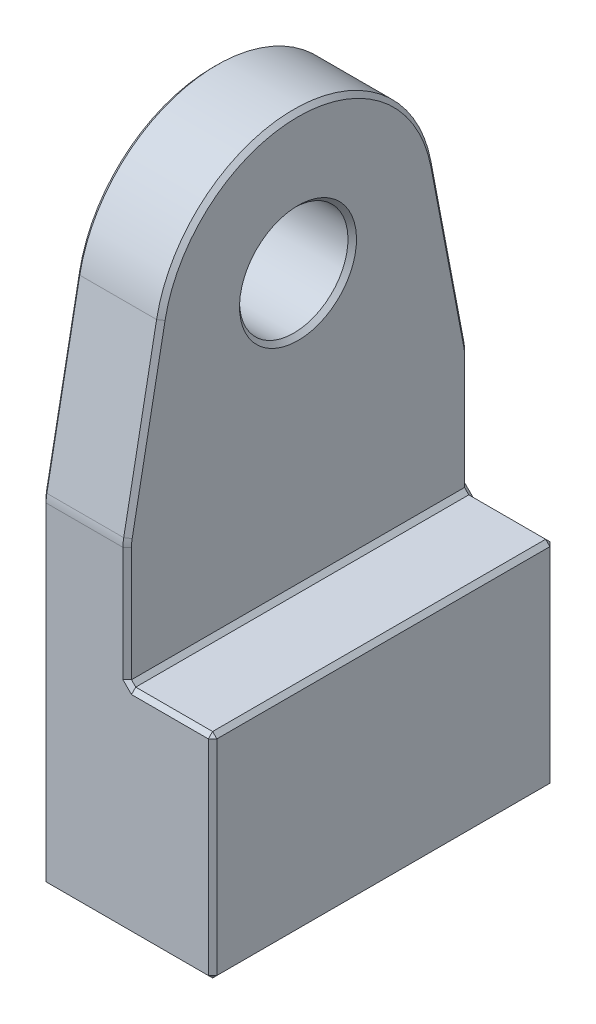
SolidWorks part; units mm, degrees
ref_plane "Спереди" through (0, 0, 0) normal (0, 0, 1) x (1, 0, 0)
ref_plane "Сверху" through (0, 0, 0) normal (0, 1, 0) x (1, 0, 0)
ref_plane "Справа" through (0, 0, 0) normal (1, 0, 0) x (0, 0, -1)
sketch "Эскиз1" plane through (0, 0, 0) normal (1, 0, 0) x (0, 0, -1)
  line L0 (-19.9115, -17.136) -> (-16.0607, 3.062)
  line L1 (-20, -18.0724) -> (-20, -57)
  line L2 (-20, -57) -> (20, -57)
  line L3 (0, 0) -> (0, -57) construction
  line L4 (20, -18.0724) -> (20, -57)
  line L5 (19.9115, -17.136) -> (16.0607, 3.062)
  circle A0 centre (0, 0) radius 6.35
  arc A1 (16.0607, 3.062) -> (-16.0607, 3.062) centre (0, 0) ccw
  arc A2 (20, -18.0724) -> (19.9115, -17.136) centre (15, -18.0724) ccw
  arc A3 (-19.9115, -17.136) -> (-20, -18.0724) centre (-15, -18.0724) ccw
  point P12 (20, -17.6)
  point P15 (-20, -17.6)
  dimension "D1" = 12.7
  dimension "D2" = 32.7
  dimension "D6" = 5
  dimension "D3" = 40
  dimension "D4" = 57
  dimension "D5" = 17.6
extrude "Бобышка-Вытянуть1" add sketch "Эскиз1" along normal blind 20
sketch "Эскиз2" plane through (0, 0, 0) normal (0, 0, 1) x (1, 0, 0)
  line L0 (0, -18.0724) -> (0, -57) construction
  line L1 (20, 16.35) -> (10, 16.35)
  line L2 (20, 16.35) -> (20, -32)
  line L3 (20, -32) -> (10, -32)
  line L4 (10, 16.35) -> (10, -32)
  dimension "D1" = 32
  dimension "D2" = 10
extrude "Вырез-Вытянуть1" cut sketch "Эскиз2" against normal mid plane 49.6
chamfer "Фаска1" distance 0.5 angle 45 26 edges at (0, 0, -6.35) (15, -32, 20) (15, -32, -20) (10, -25.0362, 20) (10, -17.6021, 19.9778) (10, -7.037, 17.9861) (10, 16.35, 0) (10, -7.037, -17.9861) (10, -17.6021, -19.9778) (10, -25.0362, -20) (10, -32, 0) (10, -6.35, 0) (0, -7.037, -17.9861) (0, 16.35, 0) (0, -7.037, 17.9861) (0, -17.6021, 19.9778) (0, -37.5362, 20) (0, -57, 0) (0, -17.6021, -19.9778) (0, -37.5362, -20) (20, -44.5, -20) (10, -57, -20) (20, -57, 0) (20, -32, 0) (20, -44.5, 20) (10, -57, 20)
